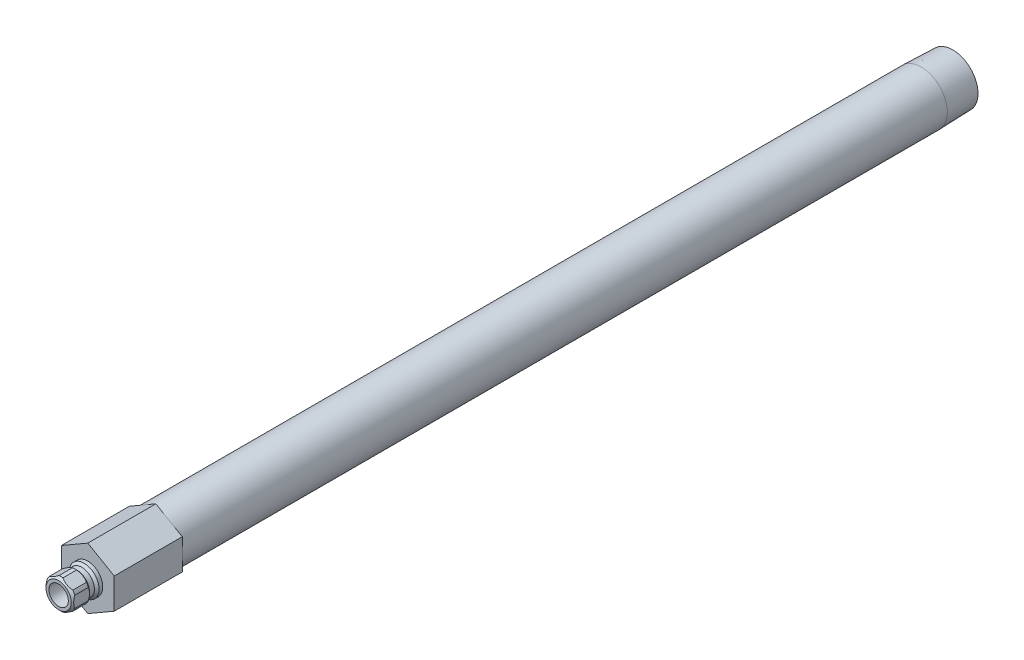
SolidWorks part; units mm, degrees
ref_plane "Front Plane" through (0, 0, 0) normal (0, 0, 1) x (1, 0, 0)
ref_plane "Top Plane" through (0, 0, 0) normal (0, 1, 0) x (1, 0, 0)
ref_plane "Right Plane" through (0, 0, 0) normal (1, 0, 0) x (0, 0, -1)
sketch "Sketch1" plane through (0, 0, 0) normal (1, 0, 0) x (0, 0, -1)
  line L0 (0, 0) -> (-12.7, 0) construction
  line L1 (-9.525, 3.175) -> (-9.525, 4.1275)
  line L2 (-3.556, 4.1275) -> (-3.556, 0) construction
  line L3 (-8.763, 4.8895) -> (-4.318, 4.8895)
  line L4 (0, 8.5725) -> (0, 0) construction
  line L5 (-3.556, 4.1275) -> (-1.9685, 4.1275)
  line L6 (-1.2065, 4.8895) -> (0, 4.8895)
  line L7 (0, 4.8895) -> (0, 8.5725)
  line L8 (-3.556, 4.1275) -> (-4.318, 4.8895)
  line L9 (-1.9685, 4.1275) -> (-1.2065, 4.8895)
  line L10 (-9.525, 4.1275) -> (-8.763, 4.8895)
  line L11 (-9.525, 3.175) -> (22.225, 3.175)
  line L12 (0, 8.5725) -> (272.2372, 8.5725)
  line L13 (272.2372, 8.5725) -> (282.575, 8.2494)
  line L14 (282.575, 8.2494) -> (282.575, 6.2611)
  line L15 (0, 0) -> (22.225, 0) construction
  line L16 (22.225, 0) -> (22.225, 3.175) construction
  line L17 (22.225, 4.8895) -> (0, 4.8895) construction
  line L18 (22.225, 3.175) -> (22.225, 6.2611)
  line L19 (22.225, 6.2611) -> (282.575, 6.2611)
  line L20 (22.225, 3.175) -> (22.225, 4.8895) construction
  dimension "D1" = 9.525
  dimension "D2" = 1.5875
  dimension "D3" = 0.762
  dimension "D4" = 45
  dimension "D5" = 5.969
  dimension "D6" = 45
  dimension "D7" = 1.79
  dimension "D8" = 10.3378
  dimension "D9" = 292.1
  dimension "D10" = 3.175
  dimension "D11" = 31.75
  dimension "D12" = 6.35
  dimension "D13" = 12.5222
  dimension "D14" = 9.779
  dimension "D15" = 17.145
revolve "Revolve1" add sketch "Sketch1" angle 360 about L0
sketch "Sketch2" plane through (0, 0, 0) normal (0, 0, 1) x (1, 0, 0)
  line L1 (-8.636, 4.986) -> (-8.636, -4.986)
  line L2 (-8.636, -4.986) -> (0, -9.972)
  line L3 (0, -9.972) -> (8.636, -4.986)
  line L4 (8.636, -4.986) -> (8.636, 4.986)
  line L5 (8.636, 4.986) -> (0, 9.972)
  line L6 (0, 9.972) -> (-8.636, 4.986)
  circle A0 centre (0, 0) radius 8.636 construction
  circle A1 centre (0, 0) radius 3.175 construction
  circle A2 centre (0, 0) radius 3.175
  dimension "D1" = 17.272
extrude "Boss-Extrude1" add sketch "Sketch2" against normal up to vertex (22.225 mm away) from vertex at 0
sketch "Sketch3" plane through (0, 0, 0) normal (0, 0, 1) x (1, 0, 0)
  line L1 (4.5212, 2.6103) -> (0, 5.2206)
  line L2 (0, 5.2206) -> (-4.5212, 2.6103)
  line L3 (-4.5212, 2.6103) -> (-4.5212, -2.6103)
  line L4 (-4.5212, -2.6103) -> (0, -5.2206)
  line L5 (0, -5.2206) -> (4.5212, -2.6103)
  line L6 (4.5212, -2.6103) -> (4.5212, 2.6103)
  circle A0 centre (0, 0) radius 4.5212 construction
  dimension "D1" = 9.0424
extrude "Cut-Extrude1" cut sketch "Sketch3" along normal through all from vertex at 3.556 flip side to cut
